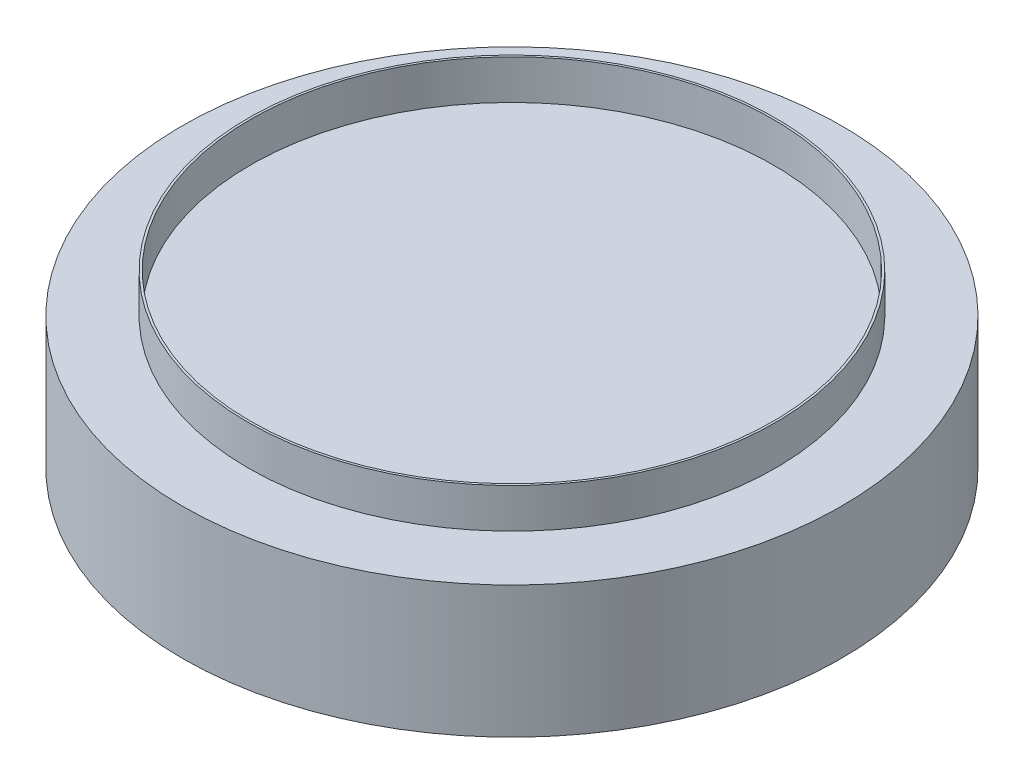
SolidWorks part; units mm, degrees
ref_plane "Alzado" through (0, 0, 0) normal (0, 0, 1) x (1, 0, 0)
ref_plane "Planta" through (0, 0, 0) normal (0, 1, 0) x (1, 0, 0)
ref_plane "Vista lateral" through (0, 0, 0) normal (1, 0, 0) x (0, 0, -1)
sketch "Croquis1" plane through (0, 0, 0) normal (0, 1, 0) x (1, 0, 0)
  circle A0 centre (0, 0) radius 150
  dimension "D1" = 300
extrude "Saliente-Extruir1" add sketch "Croquis1" along normal blind 60
sketch "Croquis2" plane through (0, 60, 0) normal (0, 1, 0) x (1, 0, 0)
  circle A2 centre (0, 0) radius 120
  circle A3 centre (0, 0) radius 120
  dimension "D1" = 30
extrude "Saliente-Extruir2" add sketch "Croquis2" along normal blind 18
sketch "Croquis3" plane through (0, 78, 0) normal (0, 1, 0) x (1, 0, 0)
  circle A2 centre (0, 0) radius 119
  circle A3 centre (0, 0) radius 119
  dimension "D1" = 1
extrude "Cortar-Extruir1" cut sketch "Croquis3" against normal blind 18
sketch "Croquis4" plane through (0, 0, 0) normal (0, -1, 0) x (1, 0, 0)
  circle A2 centre (0, 0) radius 145
  circle A3 centre (0, 0) radius 145
  dimension "D1" = 5
extrude "Cortar-Extruir2" cut sketch "Croquis4" against normal blind 15
sketch "Croquis5" plane through (0, 15, 0) normal (0, -1, 0) x (1, 0, 0)
  circle A2 centre (0, 0) radius 125
  circle A3 centre (0, 0) radius 125
  dimension "D1" = 20
extrude "Saliente-Extruir3" add sketch "Croquis5" along normal blind 5
fillet "Redondeo1" radius 10 1 edges at (0, 10, -125)
